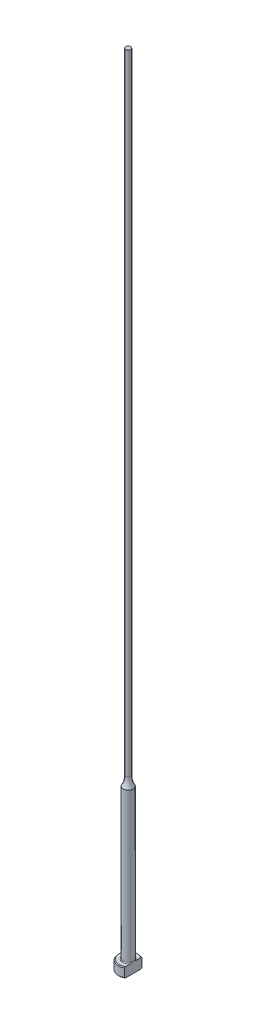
SolidWorks part; units mm, degrees
ref_plane "Front Plane" through (0, 0, 0) normal (0, 0, 1) x (1, 0, 0)
ref_plane "Top Plane" through (0, 0, 0) normal (0, 1, 0) x (1, 0, 0)
ref_plane "Right Plane" through (0, 0, 0) normal (1, 0, 0) x (0, 0, -1)
sketch "Sketch1" plane through (0, 0, 0) normal (0, 0, 1) x (1, 0, 0)
  line L0 (0, 259.9588) -> (0, -15.1925) construction
  line L1 (0, 0) -> (-3.175, 0)
  line L2 (-3.175, 0) -> (-3.175, 3.175)
  line L3 (-3.175, 3.175) -> (-1.5875, 3.175)
  line L4 (-0.7937, 53.8742) -> (-0.7937, 254)
  line L5 (-0.7937, 254) -> (0, 254)
  line L6 (0, 254) -> (0, 0)
  line L7 (-1.5875, 3.175) -> (-1.5875, 50.8)
  arc A0 (-1.5875, 50.8) -> (-0.7937, 53.8742) centre (-7.1437, 53.8742) ccw
  point P13 (-1.5875, 0)
  dimension "D1" = 6.35
  dimension "L" = 254
  dimension "D2" = 3.175
  dimension "H" = 6.35
  dimension "T" = 3.175
  dimension "D" = 1.5875
  dimension "S" = 50.8
revolve "Revolve1" add sketch "Sketch1" angle 360 about L0
chamfer "Chamfer1" distance 0.254 angle 45 2 edges at (0, 3.175, 3.175) (0, 0, 3.175)
fillet "Fillet1" radius 0.254 1 edges at (0, 3.175, 1.5875)
sketch "Sketch2" plane through (0, 0, 0) normal (0, 1, 0) x (1, 0, 0)
  line L0 (1.5875, -2.7496) -> (1.5875, 2.7496)
  circle A0 centre (0, 0) radius 3.175 construction
  arc A2 (1.5875, -2.7496) -> (1.5875, 2.7496) centre (0, 0) ccw
  circle A3 centre (0, 0) radius 3.175 construction
  circle A4 centre (0, 0) radius 1.5875 construction
extrude "Key Head" cut sketch "Sketch2" along normal up to next
